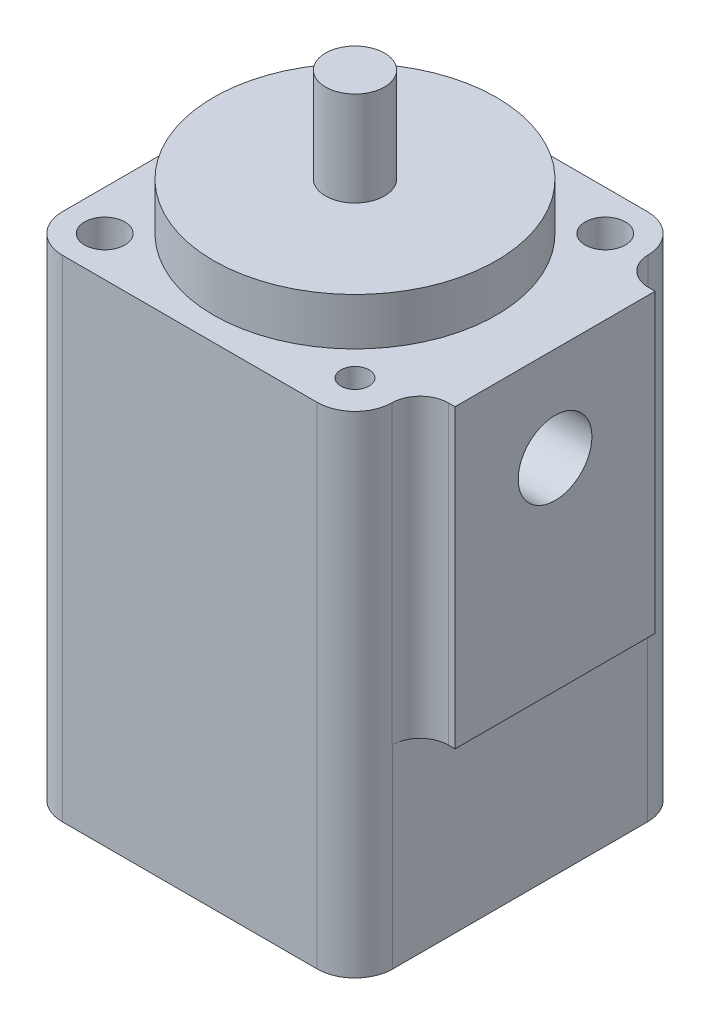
SolidWorks part; units mm, degrees
ref_plane "Front Plane" through (0, 0, 0) normal (0, 0, 1) x (1, 0, 0)
ref_plane "Top Plane" through (0, 0, 0) normal (0, 1, 0) x (1, 0, 0)
ref_plane "Right Plane" through (0, 0, 0) normal (1, 0, 0) x (0, 0, -1)
sketch "Sketch2" plane through (0, 0, 0) normal (0, 1, 0) x (1, 0, 0)
  line L1 (-22.225, -22.225) -> (22.225, -22.225)
  line L2 (-22.225, -22.225) -> (-22.225, 22.225)
  line L3 (-22.225, 22.225) -> (22.225, 22.225)
  line L4 (22.225, -22.225) -> (22.225, 22.225)
  line L5 (-22.225, -22.225) -> (22.225, 22.225) construction
  line L6 (-22.225, 22.225) -> (22.225, -22.225) construction
  point P0 (0, 0)
  dimension "D1" = 44.45
  dimension "D2" = 44.45
extrude "Boss-Extrude1" add sketch "Sketch2" along normal blind 66.04
sketch "Sketch3" plane through (0, 66.04, 0) normal (0, 1, 0) x (1, 0, 0)
  circle A0 centre (0, 0) radius 19.0373
  dimension "D1" = 38.0746
extrude "Boss-Extrude2" add sketch "Sketch3" along normal blind 6.35
sketch "Sketch4" plane through (0, 72.39, 0) normal (0, 1, 0) x (1, 0, 0)
  circle A0 centre (0, 0) radius 3.9688
  dimension "D1" = 7.9375
extrude "Cut-Extrude1" cut sketch "Sketch4" against normal blind 38.1
hole_wizard "7/16-20 Tapped Hole1" positions "Sketch6" profile "Sketch5" tap size "7/16-20" standard "Ansi Inch"
sketch "Sketch6" plane through (0, 0, 0) normal (0, -1, 0) x (1, 0, 0)
  line L0 (0, 22.225) -> (0, -22.225) construction
  line L1 (-22.225, 22.225) -> (22.225, 22.225) construction
  line L2 (22.225, -22.225) -> (-22.225, -22.225) construction
  line L3 (0, 0) -> (-13.2065, 0) construction
  point P0 (0, 9.525)
  point P1 (0, -9.525)
  dimension "D1" = 19.05
  dimension "D2" = 9.525
sketch "Sketch5" plane through (0, 0, 9.525) normal (1, 0, 0) x (0, 0, -1)
  line L0 (0, 0) -> (0, 26.162)
  line L1 (0, 26.162) -> (4.9606, 26.162)
  line L2 (4.9606, 26.162) -> (4.9606, 0)
  line L5 (4.9606, 0) -> (0, 0)
  line L10 (0, 26.162) -> (-4.9606, 26.162) construction
  line L11 (0, -6.35) -> (0, 107.95) construction
  dimension "Tap Drill Dia." = 9.9212
  dimension "Tap Drill Depth" = 26.162
  dimension "Drill Angle" = 180
fillet "Fillet1" radius 5.08 4 edges at (-22.225, 33.02, -22.225) (-22.225, 33.02, 22.225) (22.225, 33.02, -22.225) (22.225, 33.02, 22.225)
sketch "Sketch7" plane through (0, 66.04, 0) normal (0, 1, 0) x (1, 0, 0)
  line L0 (22.225, 0) -> (26.924, 0) construction
  line L1 (22.225, -17.145) -> (22.225, 17.145) construction
  line L2 (22.225, 13.462) -> (26.924, 13.462)
  line L3 (26.924, 13.462) -> (26.924, -13.462)
  line L4 (26.924, -13.462) -> (22.225, -13.462)
  line L5 (0, 0) -> (0, 17.5841) construction
  line L6 (22.225, 13.462) -> (22.225, -13.462)
  dimension "D1" = 26.924
  dimension "D2" = 26.924
extrude "Boss-Extrude3" add sketch "Sketch7" against normal blind 39.878
fillet "Fillet3" radius 3.81 2 edges at (22.225, 46.101, 13.462) (22.225, 46.101, -13.462)
hole_wizard "7/16-20 Tapped Hole2" positions "Sketch9" profile "Sketch8" tap size "7/16-20" standard "Ansi Inch"
sketch "Sketch9" plane through (26.924, 0, 0) normal (1, 0, 0) x (0, 0, -1)
  line L0 (0, 66.04) -> (0, 26.162) construction
  line L1 (-13.462, 66.04) -> (13.462, 66.04) construction
  line L2 (17.145, 26.162) -> (-17.145, 26.162) construction
  point P0 (0, 53.34)
  dimension "D1" = 12.7
sketch "Sketch8" plane through (26.924, 53.34, 0) normal (0, 1, 0) x (0, 0, -1)
  line L0 (0, 0) -> (0, 26.162)
  line L1 (0, 26.162) -> (4.9606, 26.162)
  line L2 (4.9606, 26.162) -> (4.9606, 0)
  line L5 (4.9606, 0) -> (0, 0)
  line L10 (0, 26.162) -> (-4.9606, 26.162) construction
  line L11 (0, -6.35) -> (0, 107.95) construction
  dimension "Tap Drill Dia." = 9.9212
  dimension "Tap Drill Depth" = 26.162
  dimension "Drill Angle" = 180
hole_wizard "#10-24 Tapped Hole1" positions "Sketch11" profile "Sketch10" tap size "#10-24" standard "ANSI Inch"
sketch "Sketch11" plane through (0, 66.04, 0) normal (0, 1, 0) x (-1, 0, 0)
  line L1 (0, 0) -> (0, 23.47) construction
  point P0 (16.8402, -16.8402)
  point P1 (-16.8402, 16.8402)
  dimension "D1" = 16.8402
  dimension "D2" = 16.8402
  dimension "D3" = 16.8402
  dimension "D4" = 16.8402
sketch "Sketch10" plane through (-16.8402, 66.04, -16.8402) normal (1, 0, 0) x (0, 0, 1)
  line L0 (0, 0) -> (0, 66.04)
  line L1 (0, 66.04) -> (1.8986, 66.04)
  line L2 (1.8986, 66.04) -> (1.8986, 0)
  line L5 (1.8986, 0) -> (0, 0)
  line L11 (0, -6.35) -> (0, 107.95) construction
  dimension "Thru Tap Drill Dia." = 3.7973
  dimension "Thru Tap Drill Depth" = 66.04
hole_wizard "#3 (0.213) Diameter Hole1" positions "Sketch13" profile "Sketch14" hole size "#3" standard "Ansi Inch"
sketch "Sketch13" plane through (0, 66.04, 0) normal (0, 1, 0) x (-1, 0, 0)
  line L1 (0, 0) -> (0, 17.4002) construction
  point P0 (-16.8402, -16.8402)
  point P1 (16.8402, 16.8402)
  dimension "D1" = 16.8402
  dimension "D2" = 16.8402
  dimension "D3" = 16.8402
  dimension "D4" = 16.8402
sketch "Sketch14" plane through (16.8402, 66.04, -16.8402) normal (1, 0, 0) x (0, 0, 1)
  line L0 (0, 0) -> (0, 66.04)
  line L1 (0, 66.04) -> (2.7051, 66.04)
  line L2 (2.7051, 66.04) -> (2.7051, 0)
  line L5 (2.7051, 0) -> (0, 0)
  line L11 (0, -6.35) -> (0, 107.95) construction
  dimension "Thru Hole Dia." = 5.4102
  dimension "Thru Hole Depth" = 66.04
sketch "Sketch15" [suppressed] plane through (0, 0, 0) normal (0, -1, 0) x (1, 0, 0)
  arc A0 (4.0506, 0) -> (-4.0506, 0) centre (0, 9.525) ccw
  arc A1 (-4.0506, 0) -> (4.0506, 0) centre (0, -9.525) ccw
  circle A2 centre (0, 9.525) radius 4.9606 construction
  circle A3 centre (0, -9.525) radius 4.9606 construction
  dimension "D1" = 20.701
  dimension "D2" = 20.701
extrude "Cut-Extrude2" [suppressed] cut sketch "Sketch15" against normal blind 0.254
sketch "Sketch21" plane through (41.275, 0, -41.275) normal (0, 1, 0) x (1, 0, 0)
  line L0 (-41.275, -47.625) -> (-41.275, -53.975) construction
  line L1 (-38.1, -50.8) -> (-44.45, -50.8) construction
  line L4 (-41.275, -63.5) -> (-41.275, -19.05) construction
  line L5 (-58.42, -63.5) -> (-24.13, -63.5) construction
  line L6 (-24.13, -19.05) -> (-58.42, -19.05) construction
  line L7 (-41.275, -41.275) -> (-69.2947, -41.275) construction
  circle A0 centre (-41.275, -50.8) radius 3.175
  point P4 (-41.275, -50.8)
  dimension "D1" = 9.525
  dimension "D3" = 6.35
ref_plane "Plane1" through (0, 0, 9.525) normal (0, 0, 1) x (1, 0, 0)
sketch "Port Sketch" plane through (-41.1418, 0, 9.525) normal (0, 0, -1) x (-1, 0, 0)
  line L0 (-41.1418, 0) -> (-41.1418, 45.0293) construction
  line L1 (-41.1418, 17.2346) -> (-36.1811, 14.254)
  line L2 (-36.1811, 14.254) -> (-36.1811, 11.754)
  line L3 (-36.1811, 11.754) -> (-35.5855, 11.754)
  line L4 (-35.5855, 11.754) -> (-35.5855, 2.7644)
  line L5 (-35.5855, 2.7644) -> (-35.6751, 2.854)
  line L6 (-35.6751, 2.854) -> (-35.1652, 0.4552)
  line L7 (-34.9168, 0.254) -> (-30.6418, 0.254)
  line L8 (-30.6418, 0.254) -> (-30.6418, 0)
  line L10 (-30.6418, 0) -> (-41.1418, 0)
  line L11 (-41.1418, 0) -> (-41.1418, 17.2346)
  line L12 (-46.6084, 2.854) -> (-47.1183, 0.4552) construction
  line L13 (-46.698, 2.7644) -> (-46.6084, 2.854) construction
  line L14 (-41.1418, 17.2346) -> (-46.1024, 14.254) construction
  arc A0 (-35.1652, 0.4552) -> (-34.9168, 0.254) centre (-34.9168, 0.508) ccw
  dimension "D1" = 0.254
  dimension "Countersink angle" = 118
  dimension "D3" = 45
  dimension "TapDrillDia" = 9.9212
  dimension "D5" = 12.45
  dimension "ThdMjr" = 11.1125
  dimension "SpotDia" = 21
  dimension "L3" = 0.254
  dimension "L1" = 2.6
  dimension "ThdDp" = 11.5
  dimension "TapDrillDp" = 14
  dimension "K" = 12
revolve "SAE Port" cut sketch "Port Sketch" angle 360 about L0
other "sae j1926-1 (rectangular face)<1>"
pattern_linear "LPattern1" count 2 spacing 19.05 along (0, 0, -1) of "SAE Port"
sketch "Sketch22" plane through (0, 0, 0) normal (0, 0, 1) x (1, 0, 0)
sketch "Sketch23" plane through (0, 0, 0) normal (0, 0, 1) x (1, 0, 0)
  line L0 (0, 0) -> (0, 75.9121) construction
  line L1 (-17.145, 0) -> (17.145, 0) construction
  line L2 (19.0373, 72.39) -> (-19.0373, 72.39) construction
  line L3 (0, 46.99) -> (-3.9624, 46.99)
  line L4 (0, 46.99) -> (0, 85.09)
  line L5 (0, 85.09) -> (-3.9624, 85.09)
  line L6 (-3.9624, 46.99) -> (-3.9624, 85.09)
  dimension "D1" = 7.9248
  dimension "D2" = 12.7
  dimension "D3" = 25.4
revolve "Revolve1" add sketch "Sketch23" angle 360 about L0
